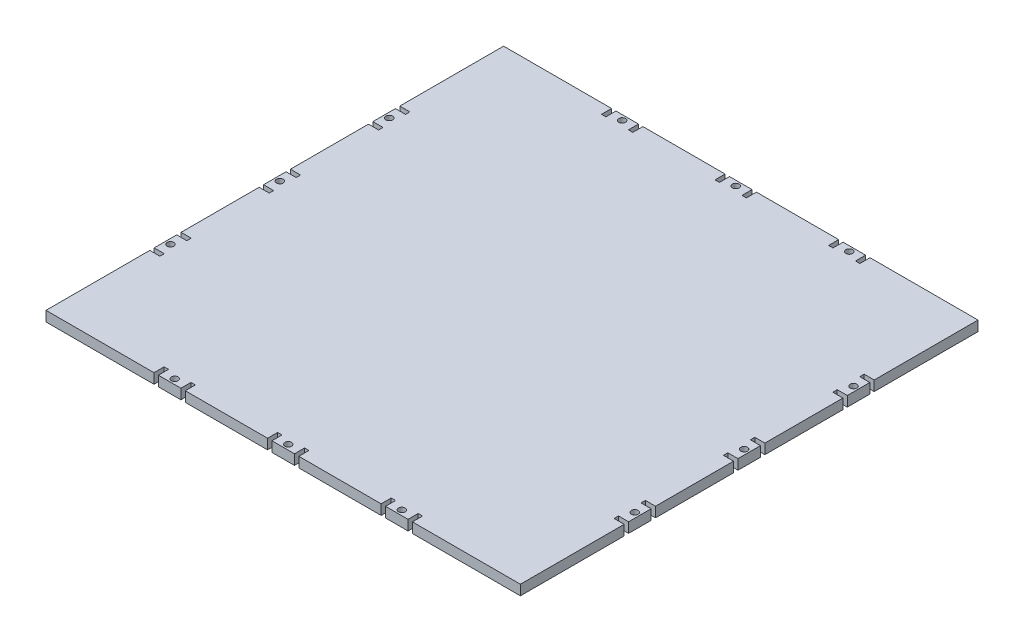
SolidWorks part; units mm, degrees
ref_plane "Front Plane" through (0, 0, 0) normal (0, 0, 1) x (1, 0, 0)
ref_plane "Top Plane" through (0, 0, 0) normal (0, 1, 0) x (1, 0, 0)
ref_plane "Right Plane" through (0, 0, 0) normal (1, 0, 0) x (0, 0, -1)
sketch "Sketch1" plane through (0, 0, 0) normal (0, 1, 0) x (1, 0, 0)
  line L1 (141, -136) -> (-141, -136)
  line L2 (141, -136) -> (141, 136)
  line L3 (141, 136) -> (-141, 136)
  line L4 (-141, -136) -> (-141, 136)
  line L5 (141, -136) -> (-141, 136) construction
  line L6 (141, 136) -> (-141, -136) construction
  point P0 (0, 0)
  dimension "D1" = 282
  dimension "D2" = 272
extrude "Boss-Extrude1" add sketch "Sketch1" along normal blind 6
sketch "Sketch2" plane through (0, 6, 0) normal (0, 1, 0) x (1, 0, 0)
  line L0 (-141, -136) -> (141, -136) construction
  line L1 (-141, 136) -> (-135, 136) construction
  line L2 (-141, 136) -> (-141, -136) construction
  line L3 (-141, -136) -> (-135, -136) construction
  line L4 (-135, 136) -> (-135, -136) construction
  line L5 (-138, 57) -> (-138, 73) construction
  line L6 (141, 136) -> (135, 136) construction
  line L7 (141, 136) -> (141, -136) construction
  line L8 (141, -136) -> (135, -136) construction
  line L9 (135, 136) -> (135, -136) construction
  line L10 (-135, -136) -> (135, -136) construction
  line L11 (-135, -136) -> (-135, -130) construction
  line L12 (-135, -130) -> (135, -130) construction
  line L13 (135, -136) -> (135, -130) construction
  line L14 (-135, 136) -> (135, 136) construction
  line L15 (-135, 136) -> (-135, 130) construction
  line L16 (-135, 130) -> (135, 130) construction
  line L17 (135, 136) -> (135, 130) construction
  line L18 (-138, 65) -> (-141, 65) construction
  line L19 (-135, 74.3) -> (-141, 74.3)
  line L20 (-135, 74.3) -> (-135, 71.7)
  line L21 (-135, 71.7) -> (-141, 71.7)
  line L22 (-141, 74.3) -> (-141, 71.7)
  line L23 (-135, 74.3) -> (-141, 71.7) construction
  line L24 (-135, 71.7) -> (-141, 74.3) construction
  line L25 (-135, 58.3) -> (-141, 58.3)
  line L26 (-141, 55.7) -> (-141, 58.3)
  line L27 (-135, 55.7) -> (-141, 55.7)
  line L28 (-135, 55.7) -> (-135, 58.3)
  line L29 (-135, 9.3) -> (-141, 9.3)
  line L30 (-135, 9.3) -> (-135, 6.7)
  line L31 (-135, 6.7) -> (-141, 6.7)
  line L32 (-141, 9.3) -> (-141, 6.7)
  line L33 (-135, -6.7) -> (-141, -6.7)
  line L34 (-141, -9.3) -> (-141, -6.7)
  line L35 (-135, -9.3) -> (-141, -9.3)
  line L36 (-135, -9.3) -> (-135, -6.7)
  line L37 (-138, -8) -> (-138, 8) construction
  line L38 (-138, 0) -> (-141, 0) construction
  line L39 (-135, 9.3) -> (-141, 6.7) construction
  line L40 (-135, 6.7) -> (-141, 9.3) construction
  line L41 (-135, -55.7) -> (-141, -55.7)
  line L42 (-135, -55.7) -> (-135, -58.3)
  line L43 (-135, -58.3) -> (-141, -58.3)
  line L44 (-141, -55.7) -> (-141, -58.3)
  line L45 (-135, -71.7) -> (-141, -71.7)
  line L46 (-141, -74.3) -> (-141, -71.7)
  line L47 (-135, -74.3) -> (-141, -74.3)
  line L48 (-135, -74.3) -> (-135, -71.7)
  line L49 (-138, -73) -> (-138, -57) construction
  line L50 (-138, -65) -> (-141, -65) construction
  line L51 (-135, -55.7) -> (-141, -58.3) construction
  line L52 (-135, -58.3) -> (-141, -55.7) construction
  line L53 (-138, 65) -> (-138, 0) construction
  line L78 (-59.5, 133) -> (-75.5, 133) construction
  line L79 (-67.5, 133) -> (-67.5, 130) construction
  line L88 (-76.8, 130) -> (-74.2, 130)
  line L89 (-76.8, 130) -> (-76.8, 136)
  line L90 (-76.8, 136) -> (-74.2, 136)
  line L91 (-74.2, 130) -> (-74.2, 136)
  line L92 (0, 0) -> (0, 130) construction
  line L93 (0, 0) -> (-135, 0) construction
  line L94 (-58.2, -136) -> (9.3, -136) construction
  line L95 (-76.8, -136) -> (-74.2, -130) construction
  line L96 (-76.8, -130) -> (-74.2, -136) construction
  line L97 (-67.5, -133) -> (-67.5, -130) construction
  line L98 (-59.5, -133) -> (-75.5, -133) construction
  line L99 (58.2, -136) -> (60.8, -136)
  line L100 (60.8, -130) -> (60.8, -136)
  line L101 (58.2, -130) -> (60.8, -130)
  line L102 (58.2, -130) -> (58.2, -136)
  line L103 (76.8, -130) -> (76.8, -136)
  line L104 (76.8, -130) -> (74.2, -130)
  line L105 (74.2, -130) -> (74.2, -136)
  line L130 (-76.8, 130) -> (-74.2, 136) construction
  line L131 (-76.8, 136) -> (-74.2, 130) construction
  line L132 (-58.2, 136) -> (-60.8, 136)
  line L133 (-60.8, 130) -> (-60.8, 136)
  line L134 (-58.2, 130) -> (-60.8, 130)
  line L135 (-58.2, 130) -> (-58.2, 136)
  line L136 (9.3, 136) -> (6.7, 136)
  line L137 (6.7, 130) -> (6.7, 136)
  line L138 (9.3, 130) -> (6.7, 130)
  line L139 (9.3, 130) -> (9.3, 136)
  line L140 (-9.3, 130) -> (-9.3, 136)
  line L141 (-9.3, 130) -> (-6.7, 130)
  line L142 (-6.7, 130) -> (-6.7, 136)
  line L143 (-9.3, 136) -> (-6.7, 136)
  line L144 (76.8, 136) -> (74.2, 136)
  line L145 (74.2, 130) -> (74.2, 136)
  line L146 (76.8, 130) -> (74.2, 130)
  line L147 (76.8, 130) -> (76.8, 136)
  line L148 (58.2, 130) -> (58.2, 136)
  line L149 (58.2, 130) -> (60.8, 130)
  line L150 (60.8, 130) -> (60.8, 136)
  line L151 (58.2, 136) -> (60.8, 136)
  line L152 (-58.2, 136) -> (9.3, 136) construction
  line L153 (76.8, -136) -> (74.2, -136)
  line L154 (-9.3, -136) -> (-6.7, -136)
  line L155 (-6.7, -130) -> (-6.7, -136)
  line L156 (-9.3, -130) -> (-6.7, -130)
  line L157 (-9.3, -130) -> (-9.3, -136)
  line L158 (9.3, -130) -> (9.3, -136)
  line L159 (9.3, -130) -> (6.7, -130)
  line L160 (6.7, -130) -> (6.7, -136)
  line L161 (9.3, -136) -> (6.7, -136)
  line L162 (-58.2, -130) -> (-58.2, -136)
  line L163 (-58.2, -130) -> (-60.8, -130)
  line L164 (-60.8, -130) -> (-60.8, -136)
  line L165 (-58.2, -136) -> (-60.8, -136)
  line L166 (-74.2, -130) -> (-74.2, -136)
  line L167 (-76.8, -136) -> (-74.2, -136)
  line L168 (-76.8, -130) -> (-76.8, -136)
  line L169 (-76.8, -130) -> (-74.2, -130)
  line L170 (138, 65) -> (138, 0) construction
  line L171 (135, -58.3) -> (141, -55.7) construction
  line L172 (135, -55.7) -> (141, -58.3) construction
  line L173 (138, -65) -> (141, -65) construction
  line L174 (138, -73) -> (138, -57) construction
  line L175 (135, 6.7) -> (141, 9.3) construction
  line L176 (135, 9.3) -> (141, 6.7) construction
  line L177 (138, 0) -> (141, 0) construction
  line L178 (138, -8) -> (138, 8) construction
  line L179 (135, 71.7) -> (141, 74.3) construction
  line L180 (135, 74.3) -> (141, 71.7) construction
  line L181 (138, 65) -> (141, 65) construction
  line L182 (138, 57) -> (138, 73) construction
  line L183 (135, -74.3) -> (135, -71.7)
  line L184 (135, -74.3) -> (141, -74.3)
  line L185 (141, -74.3) -> (141, -71.7)
  line L186 (135, -71.7) -> (141, -71.7)
  line L187 (141, -55.7) -> (141, -58.3)
  line L188 (135, -58.3) -> (141, -58.3)
  line L189 (135, -55.7) -> (135, -58.3)
  line L190 (135, -55.7) -> (141, -55.7)
  line L191 (135, -9.3) -> (135, -6.7)
  line L192 (135, -9.3) -> (141, -9.3)
  line L193 (141, -9.3) -> (141, -6.7)
  line L194 (135, -6.7) -> (141, -6.7)
  line L195 (141, 9.3) -> (141, 6.7)
  line L196 (135, 6.7) -> (141, 6.7)
  line L197 (135, 9.3) -> (135, 6.7)
  line L198 (135, 9.3) -> (141, 9.3)
  line L199 (135, 55.7) -> (135, 58.3)
  line L200 (135, 55.7) -> (141, 55.7)
  line L201 (141, 55.7) -> (141, 58.3)
  line L202 (135, 58.3) -> (141, 58.3)
  line L203 (141, 74.3) -> (141, 71.7)
  line L204 (135, 71.7) -> (141, 71.7)
  line L205 (135, 74.3) -> (135, 71.7)
  line L206 (135, 74.3) -> (141, 74.3)
  circle A0 centre (-138, 65) radius 2
  circle A1 centre (-138, 0) radius 2
  circle A2 centre (-138, -65) radius 2
  circle A14 centre (-67.5, 133) radius 2
  circle A15 centre (0, 133) radius 2
  circle A16 centre (67.5, 133) radius 2
  circle A17 centre (67.5, -133) radius 2
  circle A18 centre (0, -133) radius 2
  circle A19 centre (-67.5, -133) radius 2
  circle A20 centre (138, -65) radius 2
  circle A21 centre (138, 0) radius 2
  circle A22 centre (138, 65) radius 2
  point P22 (-138, 65)
  point P32 (-8.8193, 113.8433)
  point P38 (-138, 0)
  point P52 (-138, -65)
  point P68 (-67.5, 133)
extrude "Cut-Extrude1" cut sketch "Sketch2" against normal through all
equation "\"D2@Sketch2\"=\"D1@Sketch2\""
equation "\"D3@Sketch2\"=\"D2@Sketch2\""
equation "\"D4@Sketch2\"=\"D1@Sketch2\""
equation "\"D13@Sketch2\"=\"D11@Sketch2\""
equation "\"D14@Sketch2\"=\"D5@Sketch2\""
equation "\"D15@Sketch2\"=\"D7@Sketch2\""
equation "\"D16@Sketch2\"=\"D8@Sketch2\""
equation "\"D17@Sketch2\"=\"D6@Sketch2\""
equation "\"D18@Sketch2\"=\"D1@Sketch2\"/2"
equation "\"D21@Sketch2\"=\"D19@Sketch2\"/4"
equation "\"D24@Sketch2\"=\"D21@Sketch2\""
equation "\"D11@Sketch2\"=\"D23@Sketch2\"/4"
